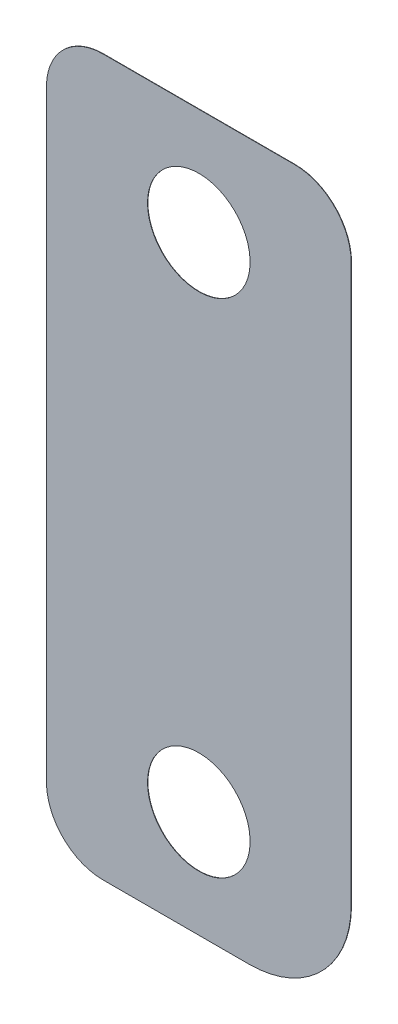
SolidWorks part; units mm, degrees
ref_plane "Front" through (0, 0, 0) normal (0, 0, 1) x (1, 0, 0)
ref_plane "Top" through (0, 0, 0) normal (0, 1, 0) x (1, 0, 0)
ref_plane "Right" through (0, 0, 0) normal (1, 0, 0) x (0, 0, -1)
ref_plane "Plane1"
sketch "Sketch1" plane through (0, 0, 71.9328) normal (0, 0, -1) x (-1, 0, 0)
  line L4 (767.7463, -5.5504) -> (754.4113, -5.5504)
  line L5 (772.1913, -51.9054) -> (772.1913, -9.9954)
  line L6 (757.5863, -56.3504) -> (767.7463, -56.3504)
  line L7 (749.9663, -9.9954) -> (749.9663, -48.7304)
  line L8 (767.7463, -5.5504) -> (754.4113, -5.5504)
  line L9 (772.1913, -51.9054) -> (772.1913, -9.9954)
  line L10 (757.5863, -56.3504) -> (767.7463, -56.3504)
  line L11 (749.9663, -9.9954) -> (749.9663, -48.7304)
  arc A4 (772.1913, -9.9954) -> (767.7463, -5.5504) centre (767.7463, -9.9954) ccw
  arc A5 (767.7463, -56.3504) -> (772.1913, -51.9054) centre (767.7463, -51.9054) ccw
  arc A6 (749.9663, -48.7304) -> (757.5863, -56.3504) centre (757.5863, -48.7304) ccw
  arc A7 (754.4113, -5.5504) -> (749.9663, -9.9954) centre (754.4113, -9.9954) ccw
  arc A8 (772.1913, -9.9954) -> (767.7463, -5.5504) centre (767.7463, -9.9954) ccw
  arc A9 (767.7463, -56.3504) -> (772.1913, -51.9054) centre (767.7463, -51.9054) ccw
  arc A10 (749.9663, -48.7304) -> (757.5863, -56.3504) centre (757.5863, -48.7304) ccw
  arc A11 (754.4113, -5.5504) -> (749.9663, -9.9954) centre (754.4113, -9.9954) ccw
sketch "Sketch2" plane through (0, 0, 71.9328) normal (0, 0, -1) x (-1, 0, 0)
  line L4 (767.7463, -6.0584) -> (754.4113, -6.0584)
  line L5 (750.4743, -9.9954) -> (750.4743, -48.7304)
  line L6 (757.5863, -55.8424) -> (767.7463, -55.8424)
  line L7 (771.6833, -51.9054) -> (771.6833, -9.9954)
  line L8 (767.7463, -6.0584) -> (754.4113, -6.0584)
  line L9 (750.4743, -9.9954) -> (750.4743, -48.7304)
  line L10 (757.5863, -55.8424) -> (767.7463, -55.8424)
  line L11 (771.6833, -51.9054) -> (771.6833, -9.9954)
  arc A4 (754.4113, -6.0584) -> (750.4743, -9.9954) centre (754.4113, -9.9954) ccw
  arc A5 (750.4743, -48.7304) -> (757.5863, -55.8424) centre (757.5863, -48.7304) ccw
  arc A6 (767.7463, -55.8424) -> (771.6833, -51.9054) centre (767.7463, -51.9054) ccw
  arc A7 (771.6833, -9.9954) -> (767.7463, -6.0584) centre (767.7463, -9.9954) ccw
  arc A8 (754.4113, -6.0584) -> (750.4743, -9.9954) centre (754.4113, -9.9954) ccw
  arc A9 (750.4743, -48.7304) -> (757.5863, -55.8424) centre (757.5863, -48.7304) ccw
  arc A10 (767.7463, -55.8424) -> (771.6833, -51.9054) centre (767.7463, -51.9054) ccw
  arc A11 (771.6833, -9.9954) -> (767.7463, -6.0584) centre (767.7463, -9.9954) ccw
extrude "Boss-Extrude1" add sketch "Sketch2" against normal blind 0.0254 flip side to cut
hole_wizard "Hole1" positions "Point_Sketch" profile "Profil_Sketch" hole size "Ø0.15" standard "ISO"
sketch "Point_Sketch" plane through (-757.4245, -6.0618, 71.9328) normal (0, 0, 1) x (-1, 0, 0)
  point P0 (3.6543, 7.4261)
  point P2 (3.6543, 42.3511)
sketch "Profil_Sketch" plane through (-761.0788, -13.4879, 71.9328) normal (1, 0, 0) x (0, 1, 0)
  line L0 (0, 0) -> (0, 0.0254)
  line L1 (0, 0.0254) -> (3.5687, 0.0254)
  line L2 (3.5687, 0.0254) -> (3.5687, 0)
  line L5 (3.5687, 0) -> (0, 0)
  line L11 (0, -6.35) -> (0, 107.95) construction
  dimension "Diameter" = 7.1374
  dimension "Thru Hole Depth" = 0.0254
other "usin_DL090_.25-20x1.75-SHCS<1>"
